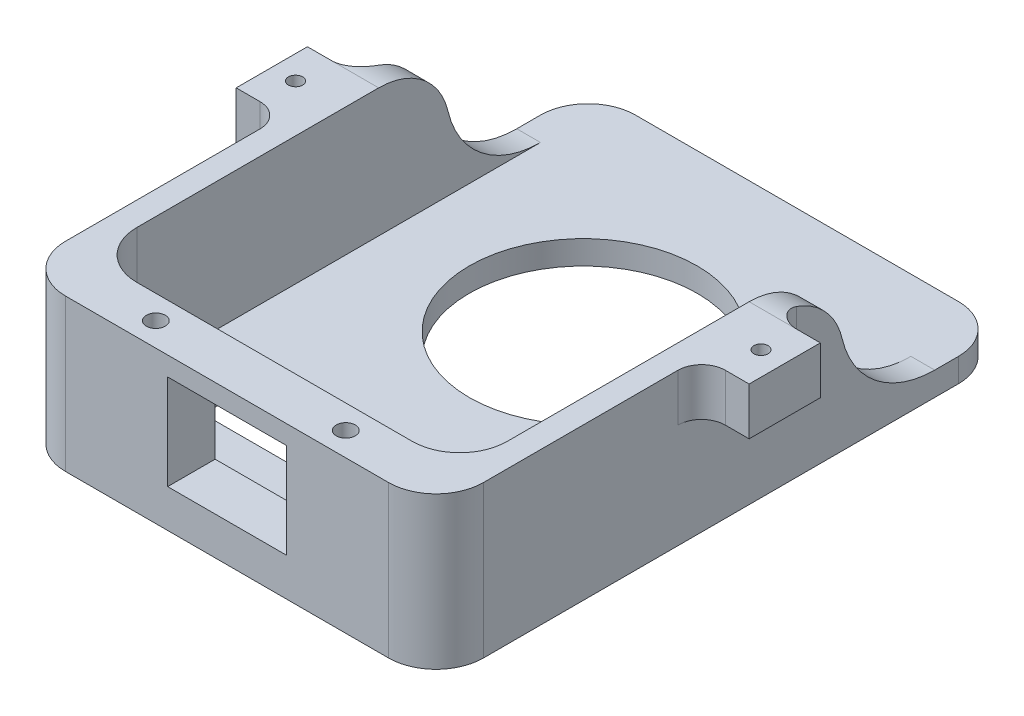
SolidWorks part; units mm, degrees
ref_plane "Plan de face" through (0, 0, 0) normal (0, 0, 1) x (1, 0, 0)
ref_plane "Plan de dessus" through (0, 0, 0) normal (0, 1, 0) x (1, 0, 0)
ref_plane "Plan de droite" through (0, 0, 0) normal (1, 0, 0) x (0, 0, -1)
sketch "Esquisse1" plane through (0, 0, 0) normal (0, 1, 0) x (1, 0, 0)
  line L0 (-44, 120) -> (44, 120)
  line L1 (44, 120) -> (44, 0)
  line L2 (44, 0) -> (-44, 0)
  line L3 (-44, 0) -> (-44, 120)
  line L4 (0, 0) -> (0, 41.2169) construction
  dimension "D1" = 88
  dimension "D2" = 120
extrude "Boss.-Extru.1" add sketch "Esquisse1" along normal blind 5
sketch "Esquisse2" plane through (0, 5, 0) normal (0, 1, 0) x (1, 0, 0)
  line L0 (-39, 120) -> (-39, 10)
  line L1 (44, 120) -> (-44, 120) construction
  line L2 (-39, 10) -> (39, 10)
  line L3 (39, 10) -> (39, 120)
  line L4 (39, 120) -> (44, 120)
  line L5 (44, 120) -> (44, 0)
  line L6 (-44, 0) -> (44, 0) construction
  line L7 (44, 0) -> (44, 120) construction
  line L8 (44, 0) -> (-44, 0)
  line L9 (-44, 0) -> (-44, 120)
  line L10 (-44, 120) -> (-39, 120)
  dimension "D1" = 5
  dimension "D2" = 5
  dimension "D3" = 10
extrude "Boss.-Extru.2" add sketch "Esquisse2" along normal blind 27
fillet "Congé3" radius 10 2 edges at (39, 18.5, -10) (-39, 18.5, -10)
sketch "Esquisse3" plane through (0, 0, 0) normal (0, 0, 1) x (1, 0, 0)
  line L0 (0, 0) -> (0, 7.4097) construction
  line L1 (-12.5, 8) -> (12.5, 8)
  line L2 (-12.5, 8) -> (-12.5, 28)
  line L3 (-12.5, 28) -> (12.5, 28)
  line L4 (12.5, 8) -> (12.5, 28)
  dimension "D1" = 25
  dimension "D2" = 20
  dimension "D3" = 8
extrude "Enlèv. mat.-Extru.1" cut sketch "Esquisse3" against normal through all
sketch "Esquisse6" plane through (0, 0, 0) normal (0, -1, 0) x (1, 0, 0)
  line L0 (44, -120) -> (-44, -120) construction
  circle A0 centre (0, -75) radius 24
  dimension "D1" = 45
extrude "Enlèv. mat.-Extru.2" cut sketch "Esquisse6" against normal through all
sketch "Esquisse7" plane through (39, 0, 0) normal (-1, 0, 0) x (0, 0, 1)
  line L0 (-120, 32) -> (-20, 32) construction
  line L1 (-120, 5) -> (-85, 5)
  line L2 (-120, 5) -> (-120, 32)
  line L3 (-120, 32) -> (-85, 32)
  line L4 (-85, 5) -> (-85, 32)
  dimension "D1" = 35
extrude "Enlèv. mat.-Extru.3" cut sketch "Esquisse7" against normal blind 27
fillet "Congé6" radius 20 1 edges at (41.5, 5, -85)
fillet "Congé7" radius 15 1 edges at (41.5, 32, -85)
sketch "Esquisse8" plane through (-39, 0, 0) normal (1, 0, 0) x (0, 0, -1)
  line L0 (20, 5) -> (120, 5) construction
  line L1 (120, 32) -> (85, 32)
  line L2 (120, 32) -> (120, 5)
  line L3 (120, 5) -> (85, 5)
  line L4 (85, 32) -> (85, 5)
  dimension "D1" = 35
extrude "Enlèv. mat.-Extru.4" cut sketch "Esquisse8" against normal blind 27
fillet "Congé8" radius 20 1 edges at (-41.5, 5, -85)
fillet "Congé9" radius 15 1 edges at (-41.5, 32, -85)
sketch "Esquisse12" plane through (0, 5, 0) normal (0, 1, 0) x (1, 0, 0)
  line L0 (29, 10) -> (-29, 10) construction
  line L1 (30, 20) -> (-30, 20)
  line L2 (30, 20) -> (30, 35)
  line L3 (30, 35) -> (-30, 35)
  line L4 (-30, 20) -> (-30, 35)
  line L5 (-39, 20) -> (-39, 105) construction
  dimension "D1" = 60
  dimension "D2" = 15
  dimension "D3" = 10
  dimension "D4" = 9
extrude "Enlèv. mat.-Extru.6" cut sketch "Esquisse12" against normal blind 15
fillet "Congé12" radius 5 4 edges at (30, 2.5, -35) (-30, 2.5, -35) (-30, 2.5, -20) (30, 2.5, -20)
sketch "Esquisse14" plane through (0, 32, 0) normal (0, 1, 0) x (1, 0, 0)
  line L0 (0, 0) -> (0, 6.5756) construction
  line L1 (-44, 0) -> (44, 0) construction
  line L2 (29, 10) -> (-29, 10) construction
  circle A0 centre (20, 5) radius 2
  circle A1 centre (-20, 5) radius 2
  dimension "D1" = 4
  dimension "D2" = 4
  dimension "D3" = 5
  dimension "D4" = 20
extrude "Enlèv. mat.-Extru.7" cut sketch "Esquisse14" against normal through all
chamfer "Chanfrein1" distance 2.5 angle 45 2 edges at (20, 0, -3) (-20, 0, -3)
fillet "Congé13" radius 10 2 edges at (44, 16, 0) (-44, 16, 0)
sketch "Esquisse21" plane through (-44, 0, 0) normal (-1, 0, 0) x (0, 0, 1)
  line L1 (-70.9265, 32) -> (-55.9265, 32)
  line L2 (-70.9265, 32) -> (-70.9265, 22)
  line L3 (-70.9265, 22) -> (-55.9265, 22)
  line L4 (-55.9265, 32) -> (-55.9265, 22)
  dimension "D1" = 15
  dimension "D2" = 10
extrude "Boss.-Extru.3" add sketch "Esquisse21" along normal blind 10
sketch "Esquisse22" plane through (44, 0, 0) normal (1, 0, 0) x (0, 0, -1)
  line L1 (70.9265, 32) -> (55.9265, 32)
  line L2 (70.9265, 32) -> (70.9265, 22)
  line L3 (70.9265, 22) -> (55.9265, 22)
  line L4 (55.9265, 32) -> (55.9265, 22)
  dimension "D1" = 15
  dimension "D2" = 10
extrude "Boss.-Extru.4" add sketch "Esquisse22" along normal blind 10
sketch "Esquisse23" plane through (0, 32, 0) normal (0, 1, 0) x (1, 0, 0)
  line L0 (0, 0) -> (0, 37.5058) construction
  line L1 (-34, 0) -> (34, 0) construction
  line L2 (54, 70.9265) -> (54, 55.9265) construction
  line L3 (54, 55.9265) -> (44, 55.9265) construction
  circle A0 centre (49, 63.4265) radius 1.5
  circle A1 centre (-49, 63.4265) radius 1.5
  dimension "D1" = 3
  dimension "D2" = 5
  dimension "D3" = 7.5
extrude "Enlèv. mat.-Extru.8" cut sketch "Esquisse23" against normal through all
fillet "Congé14" radius 5 4 edges at (-44, 27, -70.9265) (-44, 27, -55.9265) (44, 27, -55.9265) (44, 27, -70.9265)
fillet "Congé15" radius 10 2 edges at (44, 2.5, -120) (-44, 2.5, -120)
chamfer "Chanfrein2" distance 2 angle 45 2 edges at (49, 22, -61.9265) (-49, 22, -61.9265)
